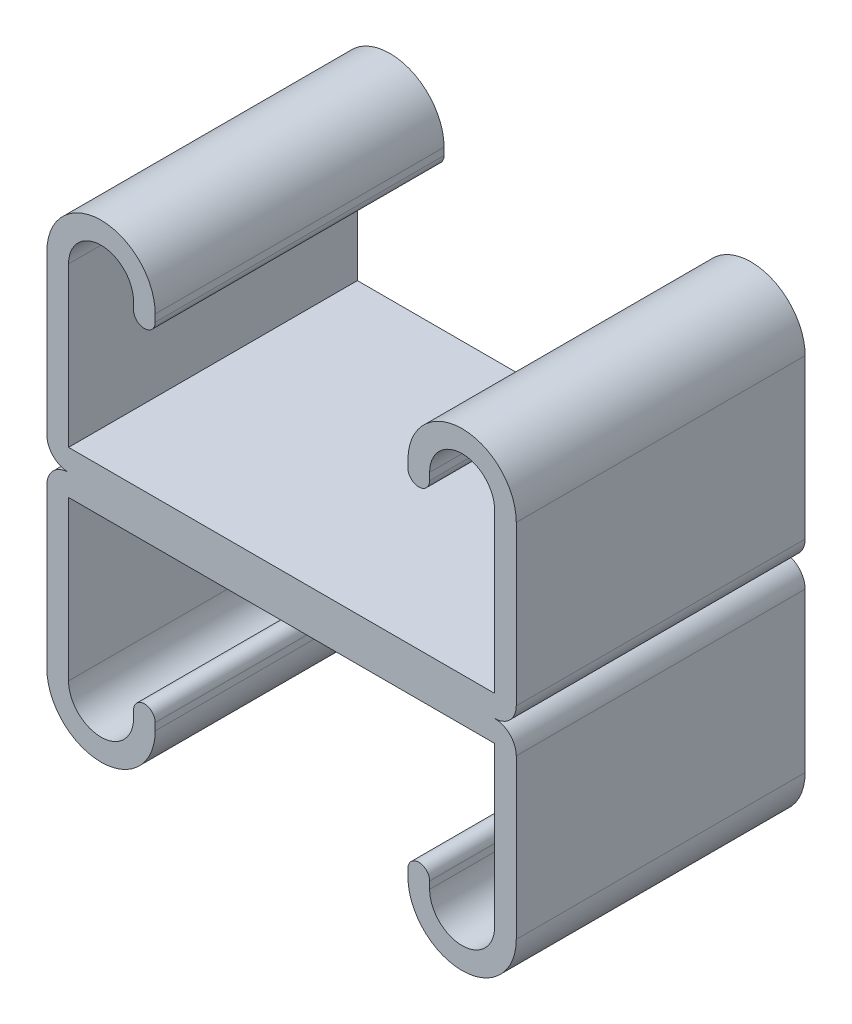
SolidWorks part; units mm, degrees
ref_plane "Plane1" through (0, 0, 0) normal (0, 0, 1) x (1, 0, 0)
ref_plane "Plane2" through (0, 0, 0) normal (0, 1, 0) x (1, 0, 0)
ref_plane "Plane3" through (0, 0, 0) normal (1, 0, 0) x (0, 0, -1)
sketch "Sketch1" plane through (0, 0, 0) normal (0, 0, 1) x (1, 0, 0)
  line L0 (-20.6375, 15.875) -> (-20.6375, 1.905)
  line L1 (-18.7325, 0) -> (18.7325, 0)
  line L2 (20.6375, 1.905) -> (20.6375, 15.875)
  line L3 (11.1125, 15.875) -> (11.1125, 15.24)
  line L4 (-11.1125, 15.875) -> (-11.1125, 15.24)
  line L5 (-13.0175, 15.875) -> (-13.0175, 15.24)
  line L6 (-18.7325, 15.875) -> (-18.7325, 1.905)
  line L7 (-18.7325, 1.905) -> (18.7325, 1.905)
  line L8 (18.7325, 1.905) -> (18.7325, 15.875)
  line L9 (13.0175, 15.875) -> (13.0175, 15.24)
  line L10 (-25.4, 20.6375) -> (25.4, 20.6375) construction
  line L11 (-12.8524, 14.2875) -> (12.8524, 14.2875) construction
  arc A0 (20.6375, 15.875) -> (11.1125, 15.875) centre (15.875, 15.875) ccw
  arc A1 (-20.6375, 15.875) -> (-11.1125, 15.875) centre (-15.875, 15.875) cw
  arc A2 (-18.7325, 0) -> (-20.6375, 1.905) centre (-18.7325, 1.905) cw
  arc A3 (18.7325, 0) -> (20.6375, 1.905) centre (18.7325, 1.905) ccw
  arc A4 (-18.7325, 15.875) -> (-13.0175, 15.875) centre (-15.875, 15.875) cw
  arc A5 (18.7325, 15.875) -> (13.0175, 15.875) centre (15.875, 15.875) ccw
  arc A6 (11.1125, 15.24) -> (13.0175, 15.24) centre (12.065, 15.24) ccw
  arc A7 (-11.1125, 15.24) -> (-13.0175, 15.24) centre (-12.065, 15.24) cw
  dimension "D1" = 1.905
  dimension "Width" = 41.275
  dimension "D6" = 9.525
  dimension "D7" = 22.225
  dimension "D9" = 6.35
  dimension "D2" = 20.6375
  dimension "gauge" = 1.905
extrude "Base-Extrude" add sketch "Sketch1" along normal mid plane 25.4
mirror "Mirror1" about plane through (0, 0, 0) normal (0, 1, 0) of "Base-Extrude"
equation "\"D7@Sketch1\" = \"Width@Sketch1\" - 2 * \"D6@Sketch1\""
equation "\"D1@Sketch1\" = \"gauge@Sketch1\""
